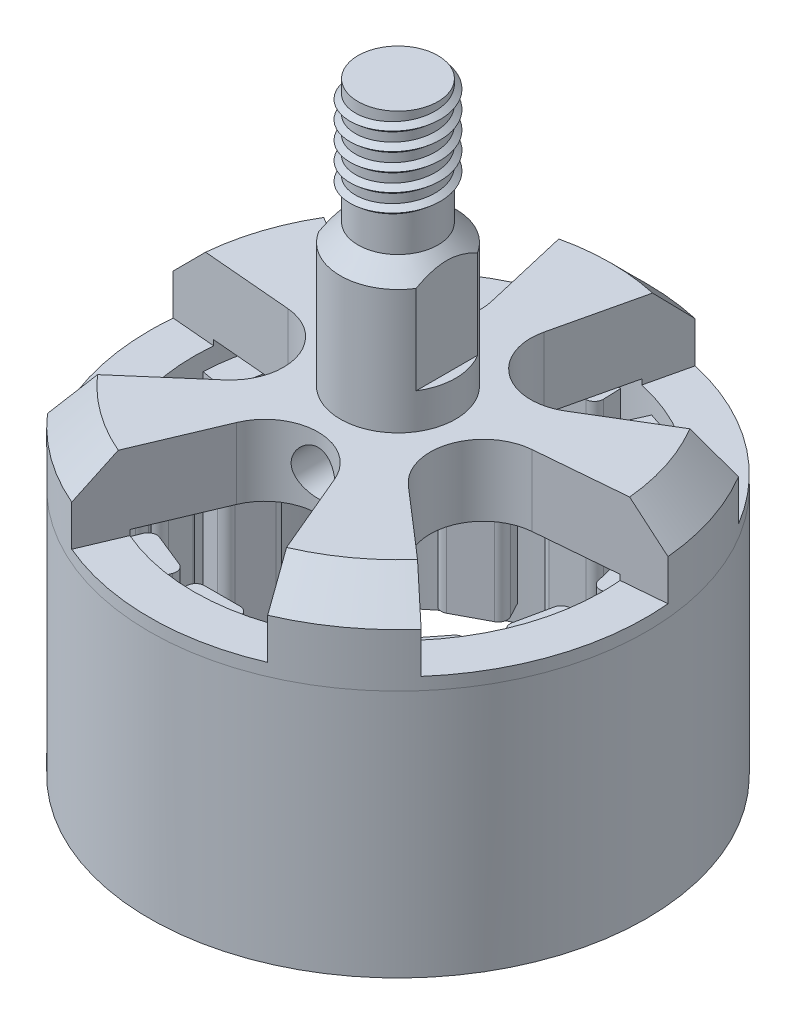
SolidWorks part; units mm, degrees
ref_plane "XY" through (0, 0, 0) normal (0, 0, 1) x (1, 0, 0)
ref_plane "XZ" through (0, 0, 0) normal (0, 1, 0) x (1, 0, 0)
ref_plane "YZ" through (0, 0, 0) normal (1, 0, 0) x (0, 0, -1)
sketch "Esquisse2" plane through (0, 0, 0) normal (0, 0, 1) x (1, 0, 0)
  line L0 (0, 74.1567) -> (0, -74.1567) construction
  line L1 (0, 0) -> (14, 0)
  line L2 (14, 0) -> (14, 17)
  line L3 (14, 17) -> (12, 19)
  line L4 (12, 19) -> (3.25, 19)
  line L5 (3.25, 19) -> (3.25, 26)
  line L6 (3.25, 26) -> (2.25, 27)
  line L7 (2.25, 27) -> (2.25, 34)
  line L8 (2.25, 34) -> (0, 34)
  line L9 (0, 0) -> (0, 34)
  dimension "D1" = 2.25
  dimension "D2" = 135
  dimension "D3" = 1
  dimension "D4" = 7
  dimension "D5" = 7
  dimension "D6" = 2
  dimension "D7" = 14
  dimension "D8" = 17
revolve "rotor brut" add sketch "Esquisse2" angle 360 about L0
sketch "Esquisse3" plane through (0, 0, 0) normal (0, -1, 0) x (1, 0, 0)
  circle A2 centre (0, 0) radius 11.5
  circle A3 centre (0, 0) radius 11.5
  dimension "D1" = 2.5
extrude "passage bobines" cut sketch "Esquisse3" against normal blind 15
sketch "Esquisse4" plane through (0, 19, 0) normal (0, 1, 0) x (1, 0, 0)
  line L0 (0, 0) -> (0, -28) construction
  line L1 (-6, -14) -> (6, -14)
  line L2 (-6, -14) -> (-2.7639, -6.3334)
  line L5 (6, -14) -> (2.7639, -6.3334)
  circle A0 centre (0, 0) radius 14 construction
  arc A1 (-2.7639, -6.3334) -> (2.7639, -6.3334) centre (0, -7.5) cw
  circle A2 centre (0, 0) radius 3.25 construction
  point P6 (0, -14)
  dimension "D2" = 3
  dimension "D1" = 12
  dimension "D3" = 7.5
extrude "refroidissement bobine" cut sketch "Esquisse4" against normal blind 4.3
pattern_circular "Répétition circulaire1" count 5 over 360 about axis through (0, 0, 0) along (0, 1, 0) of "refroidissement bobine"
sketch "Esquisse5" plane through (0, 34, 0) normal (0, 1, 0) x (-1, 0, 0)
  line L0 (-2.75, -5) -> (-3.25, 5) construction
  line L1 (3.25, -5) -> (2.75, -5)
  line L2 (3.25, -5) -> (3.25, 5)
  line L3 (3.25, 5) -> (2.75, 5)
  line L4 (2.75, -5) -> (2.75, 5)
  line L5 (-2.75, -5) -> (-3.25, -5)
  line L6 (-2.75, -5) -> (-2.75, 5)
  line L7 (-2.75, 5) -> (-3.25, 5)
  line L8 (-3.25, -5) -> (-3.25, 5)
  line L9 (2.75, -5) -> (3.25, 5) construction
  circle A0 centre (0, 0) radius 3.25 construction
  circle A1 centre (0, 0) radius 3.25 construction
  point P8 (-3, 0)
  point P9 (3, 0)
  dimension "D1" = 0.5
  dimension "D2" = 0.5
  dimension "D3" = 10
  dimension "D4" = 10
extrude "meplat" cut sketch "Esquisse5" against normal offset from surface (13 mm away) 2
sketch "Esquisse6" plane through (0, 34, 0) normal (0, 1, 0) x (1, 0, 0)
  circle A0 centre (0, 0) radius 2.25 construction
  circle A1 centre (0, 0) radius 2.25
curve "Hélice/Spirale1"
sketch "Esquisse7" plane through (0, 0, 0) normal (0, 0, 1) x (1, 0, 0)
  line L0 (-2.25, 33.12) -> (-2.25, 32.62)
  line L2 (-2.25, 34) -> (-2.25, 27) construction
  line L3 (-2.25, 32.62) -> (-2.55, 32.87)
  line L4 (-2.55, 32.87) -> (-2.25, 33.12)
  line L5 (2.25, 34) -> (-2.25, 34) construction
  point P5 (-2.25, 32.87)
  dimension "D1" = 0.5
  dimension "D2" = 0.3
  dimension "D3" = 0.88
sweep "filetage " add profiles "Esquisse7" path "Hélice/Spirale1"
ref_plane "plan aimant" through (0, 1, 0) normal (0, -1, 0) x (1, 0, 0)
sketch "Esquisse9" plane through (0, 1, 0) normal (0, -1, 0) x (1, 0, 0)
  line L0 (-1.5, 11.4018) -> (-1.5, 10.4018)
  line L1 (-1, 9.9018) -> (1, 9.9018)
  line L2 (1.5, 10.4018) -> (1.5, 11.4018)
  circle A0 centre (0, 0) radius 11.5 construction
  arc A1 (1.5, 11.4018) -> (-1.5, 11.4018) centre (0, 0) ccw
  arc A2 (1, 9.9018) -> (1.5, 10.4018) centre (1, 10.4018) ccw
  arc A3 (-1.5, 10.4018) -> (-1, 9.9018) centre (-1, 10.4018) ccw
  point P5 (0, 9.9018)
  point P10 (1.5, 9.9018)
  point P13 (-1.5, 9.9018)
  dimension "D3" = 0.5
  dimension "D1" = 1.5
  dimension "D2" = 3
extrude "aimant" add sketch "Esquisse9" against normal offset from surface (12.7 mm away) 1
pattern_circular "repet' aimants" count 14 over 360 about axis through (0, 0, 0) along (0, 1, 0) of "aimant"
sketch "Esquisse11" plane through (0, 15, 0) normal (0, -1, 0) x (1, 0, 0)
  circle A0 centre (0, 0) radius 1.5
  dimension "D1" = 3
extrude "passage axe" cut sketch "Esquisse11" against normal up to surface (6 mm away)
sketch "Esquisse12" plane through (0, 0, 0) normal (0, 0, 1) x (1, 0, 0)
  circle A0 centre (0, 17) radius 1.25
  dimension "D1" = 2.5
  dimension "D2" = 17
extrude "passage vis maintien axe" cut sketch "Esquisse12" along normal up to next
sketch "Esquisse22" plane through (0, 0, 0) normal (0, 0, 1) x (1, 0, 0)
  line L0 (-17.1847, 14) -> (23.7743, 14)
  line L1 (2.7639, 19) -> (-2.7639, 19) construction
  dimension "D1" = 5
ref_plane "Plan4" through (-14, 0, 0) normal (-1, 0, 0) x (0, 0, 1)
sketch "Esquisse27" plane through (-14, 0, 0) normal (-1, 0, 0) x (0, 0, 1)
  text T0 "dJI " font "Eras Bold ITC" height in points 10
  text T1 "2212/920KV" font "Arial" height in points 8
